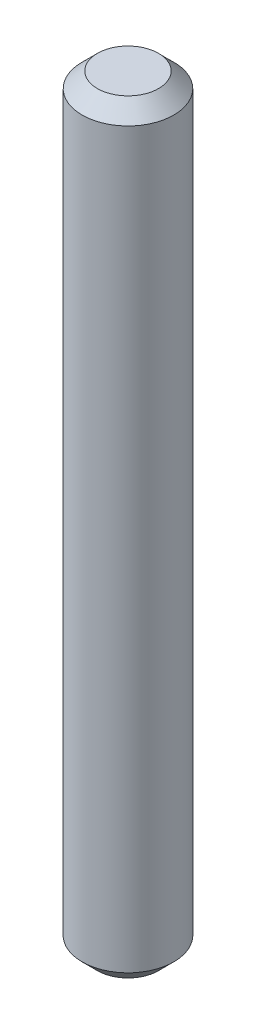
SolidWorks part; units mm, degrees
ref_plane "Plan de face" through (0, 0, 0) normal (0, 0, 1) x (1, 0, 0)
ref_plane "Plan de dessus" through (0, 0, 0) normal (0, 1, 0) x (1, 0, 0)
ref_plane "Plan de droite" through (0, 0, 0) normal (1, 0, 0) x (0, 0, -1)
sketch "Esquisse1" plane through (0, 0, 0) normal (0, 1, 0) x (1, 0, 0)
  circle A0 centre (0, 0) radius 3
extrude "Extrusion1" add sketch "Esquisse1" along normal blind 50
chamfer "Chanfrein1" distance 1 angle 45 2 edges at (0, 0, 3) (0, 50, 3)
